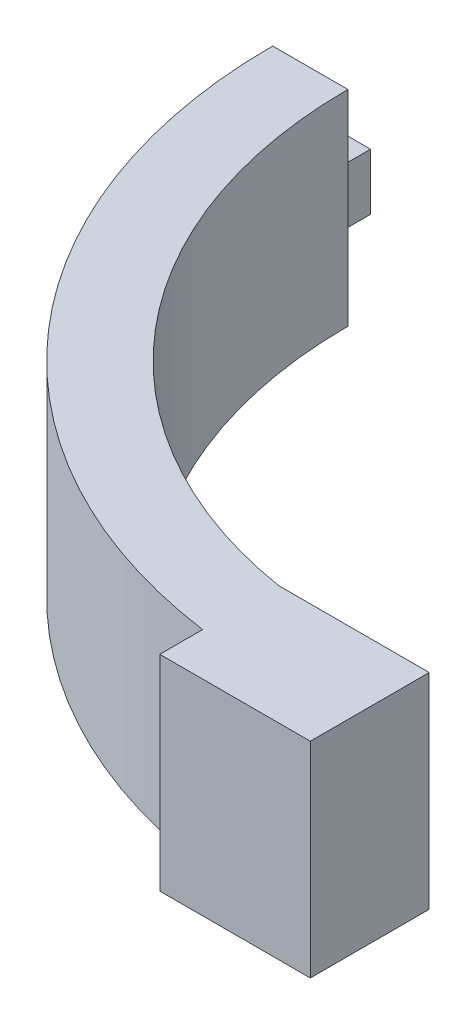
SolidWorks part; units mm, degrees
ref_plane "Front Plane" through (0, 0, 0) normal (0, 0, 1) x (1, 0, 0)
ref_plane "Top Plane" through (0, 0, 0) normal (0, 1, 0) x (1, 0, 0)
ref_plane "Right Plane" through (0, 0, 0) normal (1, 0, 0) x (0, 0, -1)
sketch "Sketch2" plane through (0, 0, 0) normal (0, 1, 0) x (1, 0, 0)
  line L0 (0, 0) -> (0, 250) construction
  line L1 (0, 250) -> (0, 280) construction
  line L4 (0, 250) -> (0, 270) construction
  line L7 (20, 280) -> (-20, 280)
  line L8 (-20, 268.6141) -> (-20, 280) construction
  line L9 (0, 125) -> (174.1964, 125) construction
  line L10 (174.1964, 125) -> (-150.7453, 125) construction
  line L11 (0, 0) -> (0, -20) construction
  line L12 (0, 0) -> (0, -30) construction
  line L13 (-20, -18.6141) -> (-20, -30)
  line L14 (20, -30) -> (-20, -30)
  line L15 (20, 0) -> (20, -30)
  line L17 (-20, 248.3896) -> (20, 248.3896)
  line L19 (-20, 1.6104) -> (20, 1.6104)
  line L20 (20, 1.6104) -> (20, 0)
  line L21 (-20, 280) -> (-20, 268.6141)
  line L22 (20, 248.3896) -> (20, 280)
  arc A0 (-20, 248.3896) -> (-20, 1.6104) centre (0, 125) ccw
  arc A1 (-20, 268.6141) -> (-20, -18.6141) centre (0, 125) ccw
  dimension "D8" = 145
  dimension "D13" = 125
  dimension "D1" = 250
  dimension "D2" = 30
  dimension "D4" = 20
  dimension "D5" = 20
  dimension "D6" = 11.3859
  dimension "D7" = 11.3859
  dimension "D9" = 31.6104
  dimension "D10" = 40
  dimension "D11" = 40
  dimension "D12" = 31.6104
extrude "Boss-Extrude2" add sketch "Sketch2" along normal blind 54.5
sketch "Sketch3" plane through (0, 54.5, 0) normal (0, 1, 0) x (1, 0, 0)
  line L0 (-145, 125) -> (58.1087, 125)
  line L1 (58.1087, 125) -> (58.1087, 296.3735)
  line L2 (58.1087, 296.3735) -> (-145, 296.3735)
  line L3 (-145, 296.3735) -> (-145, 125)
  arc A0 (-20, 268.6141) -> (-20, -18.6141) centre (0, 125) ccw construction
extrude "Cut-Extrude1" cut sketch "Sketch3" against normal through all both and the other way through all
sketch "Sketch4" plane through (0, 0, -125) normal (0, 0, -1) x (-1, 0, 0)
  line L0 (125, 27.25) -> (145, 27.25) construction
  line L1 (125, 0) -> (125, 54.5) construction
  line L2 (145, 0) -> (145, 54.5) construction
  line L3 (125, 27.25) -> (128, 27.25)
  line L4 (128, 27.25) -> (128, 34.75)
  line L5 (128, 34.75) -> (142, 34.75)
  line L6 (145, 34.75) -> (142, 34.75)
  line L7 (128, 27.25) -> (128, 19.75)
  line L9 (128, 19.75) -> (142, 19.75)
  line L10 (128, 19.75) -> (128, 34.75)
  line L11 (128, 34.75) -> (142, 34.75)
  line L12 (142, 19.75) -> (142, 34.75)
  dimension "D1" = 3
  dimension "D2" = 3
  dimension "D3" = 7.5
  dimension "D4" = 7.5
extrude "Boss-Extrude3" add sketch "Sketch4" along normal blind 9 contours L0 L7 L9 L12 | L4 L0 L12 L5
